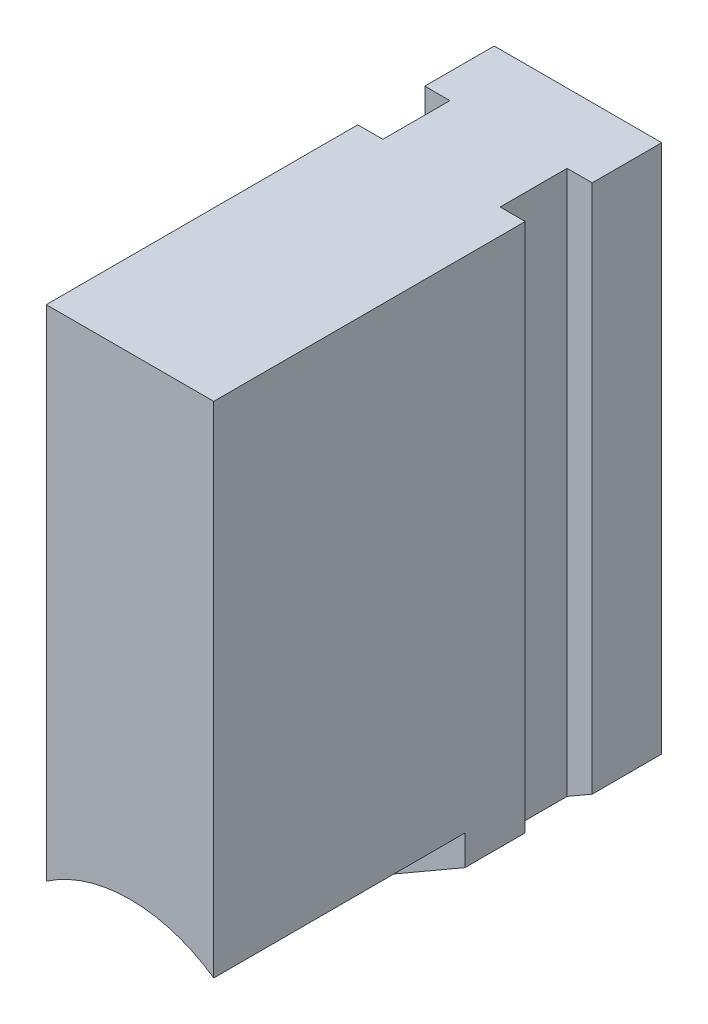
SolidWorks part; units mm, degrees
ref_plane "Face" through (0, 0, 0) normal (0, 0, 1) x (1, 0, 0)
ref_plane "Dessus" through (0, 0, 0) normal (0, 1, 0) x (1, 0, 0)
ref_plane "Droite" through (0, 0, 0) normal (1, 0, 0) x (0, 0, -1)
sketch "Esquisse1" plane through (0, 0, 0) normal (0, 0, 1) x (1, 0, 0)
  line L0 (0, 0) -> (10, 5.7735)
  line L1 (-10, 69) -> (10, 69)
  line L2 (-10, 5.7735) -> (-10, 69)
  line L4 (10, 5.7735) -> (10, 69)
  line L5 (0, 0) -> (-10, 5.7735)
  dimension "D3" = 69
  dimension "D1" = 20
  dimension "D2" = 120
  dimension "D6" = 10
extrude "Base-Extrusion" add sketch "Esquisse1" along normal blind 32.5 and the other way blind 21
sketch "Esquisse2" plane through (0, 0, 0) normal (0, 1, 0) x (1, 0, 0)
  line L0 (0, -32.5) -> (0, 21) construction
  line L3 (-17, 12.7) -> (-7, 12.7)
  line L4 (-17, 12.7) -> (-17, 4.7)
  line L5 (-17, 4.7) -> (-7, 4.7)
  line L6 (-7, 12.7) -> (-7, 4.7)
  line L7 (7, 12.7) -> (7, 4.7)
  line L8 (17, 12.7) -> (7, 12.7)
  line L9 (17, 4.7) -> (7, 4.7)
  line L10 (17, 12.7) -> (17, 4.7)
  line L11 (10, 21) -> (-10, 21) construction
  line L12 (0, -32.5) -> (0, 21) construction
  dimension "D1" = 7
  dimension "D2" = 8.3
  dimension "D3" = 8
  dimension "D4" = 10
extrude "Enlèv. mat.-Extru.3" cut sketch "Esquisse2" along normal through all
sketch "Esquisse3" plane through (0, 0, 32.5) normal (0, 0, 1) x (1, 0, 0)
  circle A0 centre (0, -5) radius 17.5
  dimension "D1" = 35
extrude "Enlèv. mat.-Extru.4" cut sketch "Esquisse3" against normal blind 30
